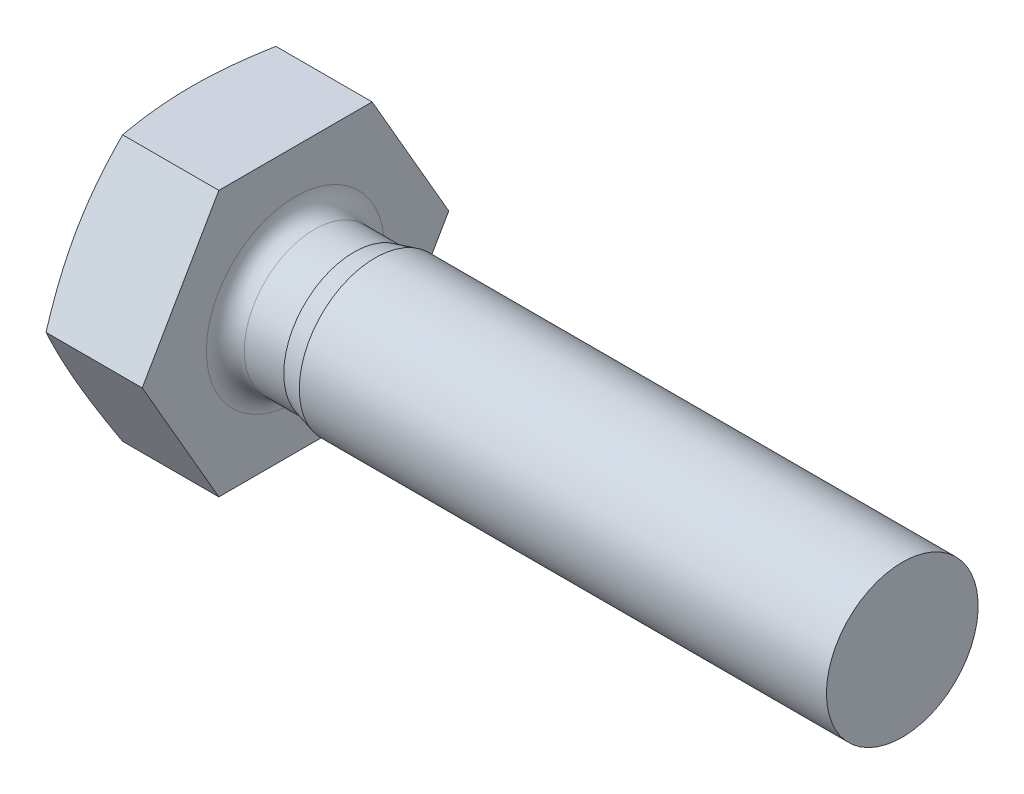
SolidWorks part; units mm, degrees
ref_plane "Front" through (0, 0, 0) normal (0, 0, 1) x (1, 0, 0)
ref_plane "Top" through (0, 0, 0) normal (0, 1, 0) x (1, 0, 0)
ref_plane "Right" through (0, 0, 0) normal (1, 0, 0) x (0, 0, -1)
sketch "Sketch2" plane through (0, 0, 0) normal (1, 0, 0) x (0, 0, -1)
  line L1 (2.0207, -3.5) -> (4.0415, 0)
  line L2 (4.0415, 0) -> (2.0207, 3.5)
  line L3 (2.0207, 3.5) -> (-2.0207, 3.5)
  line L4 (-2.0207, 3.5) -> (-4.0415, 0)
  line L5 (-4.0415, 0) -> (-2.0207, -3.5)
  line L6 (-2.0207, -3.5) -> (2.0207, -3.5)
  circle A0 centre (0, 0) radius 3.5 construction
  dimension "s" = 7
extrude "BaseHead" add sketch "Sketch2" along normal blind 2.8
sketch "Sketch10" plane through (0, 0, 0) normal (0, 1, 0) x (1, 0, 0)
  line L0 (0, 0) -> (15.3195, 0) construction
  line L1 (2.8, 2.35) -> (2.8, 0)
  line L2 (2.8, 0) -> (18.8, 0)
  line L3 (2.8, 2.0207) -> (2.8, -2.0207) construction
  line L4 (4.9, 2) -> (18.8, 2)
  line L5 (18.8, 0) -> (18.8, 2)
  line L6 (3.3, 1.85) -> (4.3402, 1.85)
  line L7 (2.8, 4.0415) -> (2.8, 2.0207) construction
  line L8 (4.9, 2) -> (4.3402, 1.85)
  line L9 (2.8, 4.0415) -> (2.8, 2.0207) construction
  arc A0 (2.8, 2.35) -> (3.3, 1.85) centre (3.3, 2.35) ccw
  dimension "r" = 0.5
  dimension "D1" = 15
  dimension "d" = 4
  dimension "a" = 2.1
  dimension "l" = 16
  dimension "Da" = 4.7
revolve "Revolve1" add sketch "Sketch10" angle 360 about L0
sketch "Sketch5" plane through (0, 0, 0) normal (0, 1, 0) x (1, 0, 0)
  line L0 (0, 4.0415) -> (0.2626, 4.0415)
  line L1 (0, 4.0415) -> (0, 2.0207) construction
  line L2 (0.2626, 4.0415) -> (0, 3.32)
  line L3 (2.8, 4.0415) -> (0, 4.0415) construction
  line L4 (0, 3.32) -> (0, 4.0415)
  line L5 (-0.3584, 0) -> (3.3946, 0) construction
  dimension "dw" = 6.64
  dimension "D2" = 20
revolve "HeadChamfer" cut sketch "Sketch5" angle 360 about L5
ref_plane "Plane1" through (1.8, 0, 0) normal (1, 0, 0) x (0, 0, -1)
sketch "Sketch6" plane through (0, 0, 0) normal (-1, 0, 0) x (0, 0, 1)
  circle A0 centre (0, 0) radius 3.32
  dimension "D1" = 6.64
extrude "Cut-Extrude1" cut sketch "Sketch6" against normal blind 1.8
sketch "Sketch7" plane through (0, 0, 0) normal (0, 1, 0) x (1, 0, 0)
  line L0 (1.8, 0) -> (6.7401, 0) construction
  line L1 (1.8, 3.32) -> (1.8, -3.32) construction
  line L2 (3.73, 0) -> (1.3, 2.5181)
  line L4 (1.3, 2.5181) -> (1.3, -2.5181)
  line L5 (1.3, -2.5181) -> (3.73, 0)
  line L7 (1.8, 2) -> (1.8, -2) construction
  dimension "D1" = 0.5
  dimension "h" = 1.93
  dimension "m" = 4
extrude "Cut-Extrude2" cut sketch "Sketch7" against normal mid plane 0.772
pattern_circular "CirPattern2" count 2 every 90 about axis through (0, 0, 0) along (1, 0, 0) of "Cut-Extrude2"
sketch "Sketch8" plane through (0, 0, 0) normal (0, 0, 1) x (1, 0, 0)
  line L0 (18.8, 1.567) -> (19.05, 2)
  line L1 (19.05, 2) -> (19.05, 2.5)
  line L2 (19.05, 2.5) -> (18.55, 2.5)
  line L3 (18.55, 2.5) -> (18.55, 2)
  line L4 (18.55, 2) -> (18.8, 1.567)
  line L5 (14.8, 0) -> (0, 0) construction
  line L6 (18.8, -2) -> (18.8, 2) construction
  line L7 (18.8, 2) -> (4.9, 2) construction
  dimension "D1" = 0.5
revolve "Cut-Revolve10" [suppressed] cut sketch "Sketch8" angle 360 about L5
pattern_linear "LPattern10" [suppressed] count 23 along (1, 0, 0)
equation "\"D1@Sketch6\" = \"dw@Sketch5\""
equation "\"D1@Cut-Extrude1\" = \"k@BaseHead\" - \"k1@Plane1\""
equation "\"t@Cut-Extrude2\" = 0.4 * \"h@Sketch7\""
equation "\"D1@Sketch8\" =  ( \"d@Sketch10\" - \"D2@ThreadCosmetic1\" )  / 2"
equation "\"pitch@LPattern10\" = \"D1@Sketch8\" * 1.2"
equation "\"D1@LPattern10\" =  ( \"l@Sketch10\" - \"a@Sketch10\" )  / \"pitch@LPattern10\""
